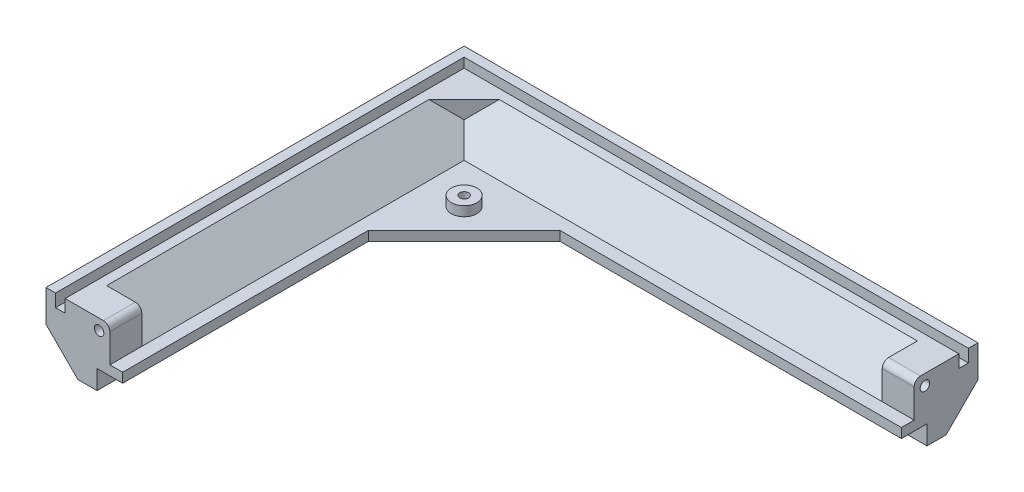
SolidWorks part; units mm, degrees
ref_plane "Front Plane" through (0, 0, 0) normal (0, 0, 1) x (1, 0, 0)
ref_plane "Top Plane" through (0, 0, 0) normal (0, 1, 0) x (1, 0, 0)
ref_plane "Right Plane" through (0, 0, 0) normal (1, 0, 0) x (0, 0, -1)
sketch "Sketch2" plane through (0, 0, 6.5477) normal (0, 0, 1) x (1, 0, 0)
  line L0 (-60.0579, -10) -> (-60.0579, 0)
  line L2 (-57.0579, -4) -> (-54.0579, -4)
  line L7 (-60.0579, -10) -> (-50.0579, -10) construction
  line L8 (-50.0579, -10) -> (-50.0579, -20) construction
  line L9 (-50.0579, -20) -> (-60.0579, -10)
  line L10 (-50.0579, -20) -> (-40.0579, -20)
  line L11 (-40.0579, -20) -> (-40.0579, -17)
  line L12 (-40.0579, -17) -> (-44.0579, -17)
  line L13 (-44.0579, -17) -> (-44.0579, -14)
  line L14 (-44.0579, -14) -> (-40.0579, -14)
  line L15 (-40.0579, -14) -> (-40.0579, -11)
  line L26 (-57.0579, 0) -> (-57.0579, -4)
  line L27 (-54.0579, -4) -> (-54.0579, 0)
  line L29 (-40.0579, -11) -> (-51.0579, 0)
  line L30 (-60.0579, 0) -> (-57.0579, 0)
  line L31 (-54.0579, 0) -> (-51.0579, 0)
extrude "Boss-Extrude2" add sketch "Sketch2" along normal blind 111 separate body
sketch "Sketch3" plane through (-40.0579, 0, 0) normal (1, 0, 0) x (0, 0, -1)
  line L1 (-6.5477, -14) -> (-2.5477, -14)
  line L2 (-2.5477, -14) -> (-2.5477, -17)
  line L3 (-2.5477, -17) -> (-6.5477, -17)
  line L4 (-6.5477, -17) -> (-6.5477, -20)
  line L5 (-6.5477, -20) -> (3.4523, -20)
  line L7 (7.4523, -4) -> (10.4523, -4)
  line L11 (13.4523, -10) -> (3.4523, -20)
  line L21 (-6.5477, -14) -> (-6.5477, -11)
  line L22 (13.4523, -10) -> (13.4523, 0)
  line L23 (13.4523, 0) -> (10.4523, 0)
  line L24 (10.4523, 0) -> (10.4523, -4)
  line L25 (7.4523, -4) -> (7.4523, 0)
  line L26 (7.4523, 0) -> (4.4523, 0)
  line L27 (4.4523, 0) -> (-6.5477, -11)
extrude "Boss-Extrude3" add sketch "Sketch3" along normal blind 141 separate body
sketch "Sketch17" plane through (0, 0, 0) normal (0, 1, 0) x (1, 0, 0)
  line L0 (-60.0579, -6.5477) -> (-60.0579, 19.5864) construction
  line L1 (-40.0579, 13.4523) -> (-60.0579, 13.4523)
  line L2 (-60.0579, 13.4523) -> (-60.0579, -6.5477)
  line L3 (-60.0579, -6.5477) -> (-40.0579, -6.5477)
  line L4 (-40.0579, -6.5477) -> (-40.0579, 13.4523)
extrude "Boss-Extrude9" add sketch "Sketch17" against normal blind 20
sketch "Sketch8" plane through (-40.0579, 0, 0) normal (1, 0, 0) x (0, 0, -1)
  line L4 (-2.5477, -17) -> (-2.5477, -14)
  line L5 (-2.5477, -14) -> (-6.5477, -14)
  line L6 (-6.5477, -14) -> (-6.5477, -17)
  line L7 (-6.5477, -17) -> (-2.5477, -17)
extrude "Cut-Extrude4" cut sketch "Sketch8" against normal blind 4
sketch "Sketch9" plane through (-40.0579, 0, 0) normal (1, 0, 0) x (0, 0, -1)
  line L4 (7.4523, -4) -> (10.4523, -4)
  line L5 (10.4523, -4) -> (10.4523, 0)
  line L6 (10.4523, 0) -> (7.4523, 0)
  line L7 (7.4523, 0) -> (7.4523, -4)
extrude "Cut-Extrude5" cut sketch "Sketch9" against normal blind 17
sketch "Sketch18" plane through (0, 0, 6.5477) normal (0, 0, 1) x (1, 0, 0)
  line L0 (-57.0579, -4) -> (-57.0579, 0)
  line L1 (-57.0579, 0) -> (-54.0579, 0)
  line L2 (-54.0579, 0) -> (-54.0579, -4)
  line L3 (-54.0579, -4) -> (-57.0579, -4)
extrude "Cut-Extrude9" cut sketch "Sketch18" against normal blind 14
sketch "Sketch11" plane through (0, 0, 0) normal (0, 1, 0) x (1, 0, 0)
  line L0 (-51.0579, -6.5477) -> (-40.0579, 4.4523)
  line L1 (-40.0579, 4.4523) -> (-40.0579, -6.5477)
  line L2 (-40.0579, -6.5477) -> (-51.0579, -6.5477)
extrude "Cut-Extrude7" cut sketch "Sketch11" against normal blind 11
sketch "Sketch12" plane through (-40.0579, 0, 0) normal (-1, 0, 0) x (0, 0, 1)
  line L0 (6.5477, -11) -> (-4.4523, -11)
  line L1 (-4.4523, -11) -> (-4.4523, 0)
  line L2 (-4.4523, 0) -> (6.5477, -11)
extrude "Boss-Extrude5" add sketch "Sketch12" along normal blind 10
sketch "Sketch13" plane through (0, 0, 6.5477) normal (0, 0, -1) x (-1, 0, 0)
  line L0 (40.0579, -11) -> (51.0579, -11)
  line L1 (51.0579, -11) -> (51.0579, 0)
  line L2 (51.0579, 0) -> (40.0579, -11)
extrude "Boss-Extrude6" add sketch "Sketch13" along normal blind 10
sketch "Sketch14" plane through (0, -17, 0) normal (0, 1, 0) x (1, 0, 0)
  line L0 (-44.0579, -2.5477) -> (-44.0579, -147.5477)
  line L1 (-44.0579, -147.5477) -> (-40.0579, -147.5477)
  line L2 (-40.0579, -147.5477) -> (-40.0579, -6.5477)
  line L3 (-40.0579, -6.5477) -> (100.9421, -6.5477)
  line L4 (100.9421, -6.5477) -> (100.9421, -2.5477)
  line L5 (100.9421, -2.5477) -> (-44.0579, -2.5477)
extrude "Cut-Extrude8" cut sketch "Sketch14" against normal through all
sketch "Sketch15" plane through (0, 0, 6.5477) normal (0, 0, 1) x (1, 0, 0)
  line L4 (-40.0579, -14) -> (-40.0579, -11)
  line L5 (-40.0579, -11) -> (100.9421, -11)
  line L6 (100.9421, -11) -> (100.9421, -14)
  line L7 (100.9421, -14) -> (-40.0579, -14)
extrude "Boss-Extrude7" add sketch "Sketch15" along normal blind 4
sketch "Sketch16" plane through (-40.0579, 0, 0) normal (1, 0, 0) x (0, 0, -1)
  line L4 (-10.5477, -11) -> (-10.5477, -14)
  line L5 (-10.5477, -14) -> (-117.5477, -14)
  line L6 (-117.5477, -14) -> (-117.5477, -11)
  line L7 (-117.5477, -11) -> (-10.5477, -11)
extrude "Boss-Extrude8" add sketch "Sketch16" along normal blind 4
chamfer "Chamfer1" distance 30 angle 45 1 edges at (-36.0579, -12.5, 10.5477)
sketch "Sketch19" plane through (-40.0579, 0, 0) normal (1, 0, 0) x (0, 0, -1)
  line L0 (13.4523, -10) -> (3.4523, -20)
  line L1 (3.4523, -20) -> (13.4523, -20)
  line L2 (13.4523, -20) -> (13.4523, -10)
extrude "Cut-Extrude10" cut sketch "Sketch19" against normal through all
sketch "Sketch20" plane through (0, 0, 6.5477) normal (0, 0, 1) x (1, 0, 0)
  line L0 (-50.0579, -20) -> (-60.0579, -10)
  line L1 (-60.0579, -10) -> (-60.0579, -20)
  line L2 (-60.0579, -20) -> (-50.0579, -20)
extrude "Cut-Extrude11" cut sketch "Sketch20" against normal through all
chamfer "Chamfer2" distance 20 angle 45 1 edges at (-44.0579, -17, 2.5477)
sketch "Sketch21" plane through (0, -14, 0) normal (0, -1, 0) x (1, 0, 0)
  line L0 (-34.0579, 12.5477) -> (-21.0579, 25.5477) construction
  line L1 (-44.0579, 22.5477) -> (-24.0579, 2.5477) construction
  line L2 (-6.0579, 10.5477) -> (-36.0579, 40.5477) construction
  circle A0 centre (-27.5579, 19.0477) radius 1.4
extrude "Cut-Extrude12" cut sketch "Sketch21" against normal blind 10
sketch "Sketch22" plane through (100.9421, 0, 0) normal (1, 0, 0) x (0, 0, -1)
  line L0 (-6.5477, -11) -> (-6.5477, -0.5134) construction
  line L1 (4.4523, 0) -> (-6.5477, 0) construction
  line L2 (-6.5477, 0) -> (-6.5477, -11) construction
  line L3 (4.4523, 0) -> (-6.5477, -11)
  line L4 (-6.5477, -11) -> (-6.5477, 0)
  line L5 (-6.5477, 0) -> (4.4523, 0)
  line L6 (-1.0477, -5.5) -> (-3.1691, -3.3787) construction
  circle A0 centre (-3.1691, -3.3787) radius 1.5
extrude "Boss-Extrude10" add sketch "Sketch22" against normal blind 10
sketch "Sketch23" plane through (0, 0, 117.5477) normal (0, 0, 1) x (1, 0, 0)
  line L0 (-51.0579, 0) -> (-34.6904, 0) construction
  line L1 (-40.0579, -11) -> (-40.0579, 0) construction
  line L2 (-51.0579, 0) -> (-40.0579, -11)
  line L3 (-40.0579, -11) -> (-40.0579, 0)
  line L4 (-40.0579, 0) -> (-51.0579, 0)
  line L5 (-45.5579, -5.5) -> (-43.4365, -3.3787) construction
  circle A0 centre (-43.4365, -3.3787) radius 1.5
extrude "Boss-Extrude11" add sketch "Sketch23" against normal blind 10
fillet "Fillet1" radius 2 2 edges at (95.9421, 0, 6.5477) (-40.0579, 0, 112.5477)
sketch "Esquisse1" plane through (0, -11, 0) normal (0, 1, 0) x (1, 0, 0)
  circle A0 centre (-27.5579, -19.0477) radius 4
  circle A1 centre (-27.5579, -19.0477) radius 1.4
extrude "Boss.-Extru.1" add sketch "Esquisse1" along normal blind 3
